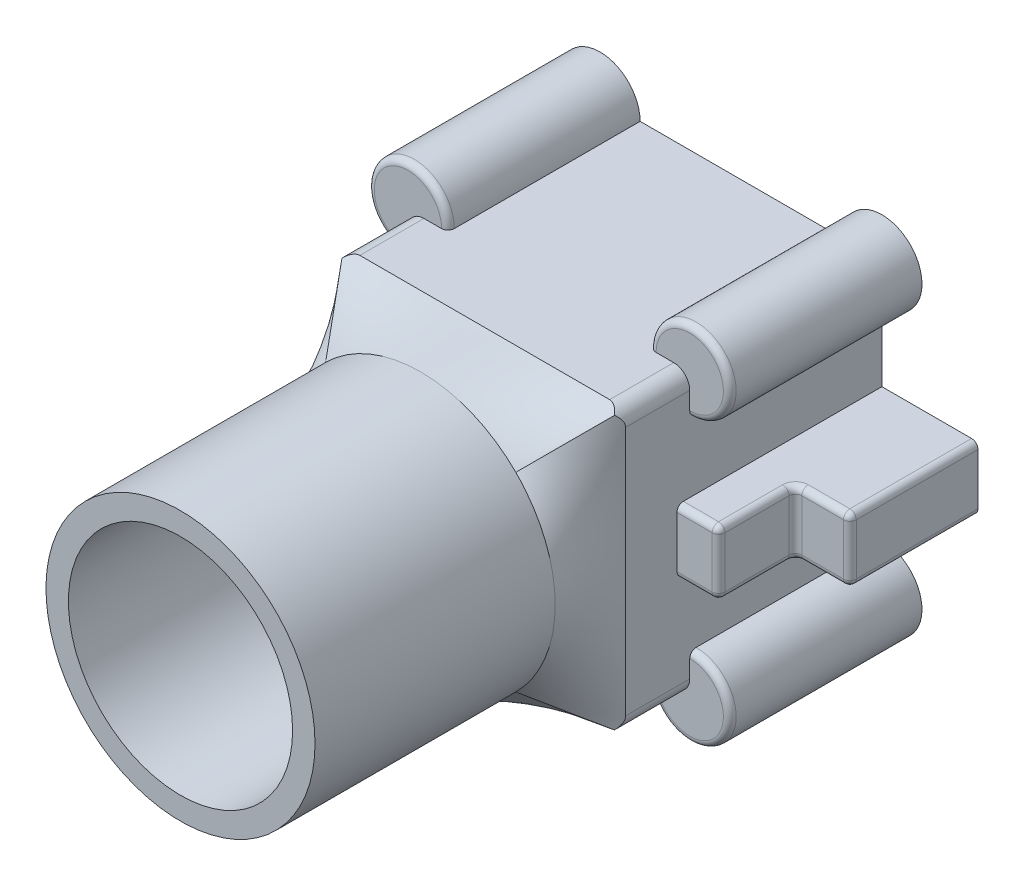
SolidWorks part; units mm, degrees
ref_plane "Front Plane" through (0, 0, 0) normal (0, 0, 1) x (1, 0, 0)
ref_plane "Top Plane" through (0, 0, 0) normal (0, 1, 0) x (1, 0, 0)
ref_plane "Right Plane" through (0, 0, 0) normal (1, 0, 0) x (0, 0, -1)
ref_plane "Plane1" through (0, 0, 500) normal (0, 0, 1) x (1, 0, 0)
sketch "Sketch1" plane through (0, 0, 500) normal (0, 0, 1) x (1, 0, 0)
  circle A0 centre (0, 0) radius 210
extrude "Boss-Extrude1" add sketch "Sketch1" along normal blind 375
sketch "Sketch8" plane through (0, 0, 0) normal (0, 0, 1) x (1, 0, 0)
  line L1 (-220, -220) -> (220, -220)
  line L2 (-220, -220) -> (-220, 220)
  line L3 (-220, 220) -> (220, 220)
  line L4 (220, -220) -> (220, 220)
  line L5 (-220, -220) -> (220, 220) construction
  line L6 (-220, 220) -> (220, -220) construction
  point P0 (0, 0)
  dimension "D1" = 440
extrude "Boss-Extrude2" add sketch "Sketch8" along normal blind 400
sketch "Sketch7" plane through (0, 0, 875) normal (0, 0, 1) x (1, 0, 0)
  circle A0 centre (0, 0) radius 175
extrude "Cut-Extrude1" cut sketch "Sketch7" against normal blind 250
loft "Loft1" add
sketch "Sketch9" plane through (0, 0, 0) normal (0, 0, 1) x (1, 0, 0)
  circle A0 centre (-220, 220) radius 62.5
  dimension "D1" = 125
extrude "Boss-Extrude3" add sketch "Sketch9" along normal blind 300
mirror "Mirror1" about plane through (0, 0, 0) normal (0, 1, 0) of "Boss-Extrude3"
sketch "Sketch10" plane through (0, -220, 0) normal (0, -1, 0) x (1, 0, 0)
  line L0 (0, -331.375) -> (0, 331.375) construction
  line L1 (-75, 0) -> (75, 0)
  line L2 (-75, 0) -> (-75, 270)
  line L3 (-75, 270) -> (75, 270)
  line L4 (75, 0) -> (75, 270)
  line L5 (-75, 0) -> (75, 270) construction
  line L6 (-75, 270) -> (75, 0) construction
  line L7 (-157.5, 0) -> (157.5, 0) construction
  point P0 (0, 135)
  dimension "D1" = 150
  dimension "D2" = 270
extrude "Boss-Extrude4" add sketch "Sketch10" along normal blind 100
fillet "Fillet4" radius 25 4 edges
sketch "Sketch11" plane through (0, 0, 0) normal (0, 1, 0) x (1, 0, 0)
  line L0 (220, -400) -> (220, -300) construction
  line L1 (220, -320) -> (220, -300)
  line L2 (220, -300) -> (220, 0)
  line L3 (-331.375, 0) -> (331.375, 0) construction
  line L4 (220, 0) -> (370, 0)
  line L5 (370, 0) -> (370, -200)
  line L6 (370, -200) -> (285, -200)
  line L7 (285, -200) -> (285, -320)
  line L8 (285, -320) -> (220, -320)
  dimension "D1" = 150
  dimension "D2" = 200
  dimension "D3" = 85
  dimension "D4" = 120
extrude "Boss-Extrude5" add sketch "Sketch11" along normal mid plane 100
fillet "Fillet2" radius 10 20 edges at (252.5, -50, 320) (285, -50, 260) (285, 0, 320) (327.5, -50, 200) (285, 0, 200) (370, -50, 100) (370, 0, 200) (252.5, 50, 320) (285, 50, 260) (327.5, 50, 200) (370, 50, 100) (-264.1942, 264.1942, 300) (264.1942, 264.1942, 300) (-264.1942, -264.1942, 300) (264.1942, -264.1942, 300) (75, -270, 270) (-75, -270, 270) (75, -320, 135) (0, -320, 270) (-75, -320, 135)
equation "\"connector1_l\"= 250"
equation "\"connector1_d\"= 350"
equation "\"connector2_l\"= 220"
equation "\"connector2_d\"= 280"
equation "\"member1_d\"= 350"
equation "\"member2_d\"= 280"
equation "\"box_l\"= 150"
equation "\"D1@Sketch7\"=\"connector1_d\""
equation "\"D1@Cut-Extrude1\"=\"connector1_l\""
equation "\"end_l\" = 375"
equation "\"end_d\" = 420"
equation "\"p1_m2_l\" = 250"
equation "\"p1_m1_l\" = 200"
equation "\"D1@Boss-Extrude1\"=\"end_l\""
equation "\"D1@Sketch1\"=\"end_d\""
equation "\"p2_m_l\" = 7500"
equation "\"p3_m_l\" = 4000"
equation "\"p3_offset\" = 400"
equation "\"end2_l\" = 300"
equation "\"end2_d\" = 350"
equation "\"p4_m_l\" = 3500"
equation "\"base_h\" = 400"
equation "\"D1@Plane1\"=\"base_h\"+100"
equation "\"D1@Boss-Extrude2\"=\"base_h\""
